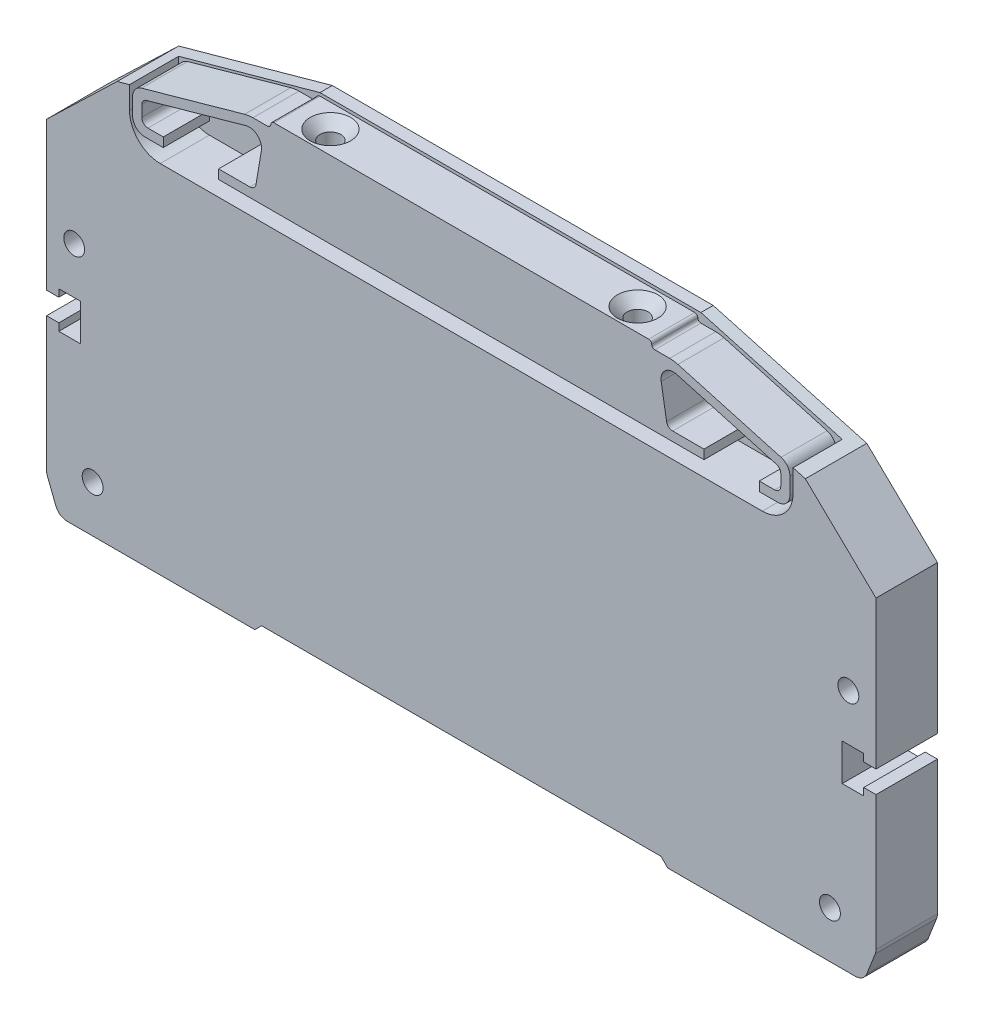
SolidWorks part; units mm, degrees
ref_plane "前视基准面" through (0, 0, 0) normal (0, 0, 1) x (1, 0, 0)
ref_plane "上视基准面" through (0, 0, 0) normal (0, 1, 0) x (1, 0, 0)
ref_plane "右视基准面" through (0, 0, 0) normal (1, 0, 0) x (0, 0, -1)
sketch "草图1" plane through (0, 0, 0) normal (0, 0, 1) x (1, 0, 0)
  line L0 (-67.5, 53.9) -> (-55.9997, 64.967)
  line L1 (-67.5, 29.8) -> (-67.5, 53.9)
  line L2 (-67.5, 29.8) -> (-65.5, 29.8)
  line L3 (-65.5, 29.8) -> (-65.5, 31)
  line L4 (-65.5, 31) -> (-62, 31)
  line L5 (-62, 31) -> (-62, 25)
  line L6 (-65.5, 25) -> (-65.5, 26.2)
  line L7 (-62, 25) -> (-65.5, 25)
  line L8 (-65.5, 26.2) -> (-67.5, 26.2)
  line L9 (-67.5, 26.2) -> (-67.5, 4.3788)
  line L10 (-67.3608, 3.6488) -> (-65.9948, 0.1687)
  line L11 (-64.1333, -1.1) -> (-33.6, -1.1)
  line L12 (-33.6, -1.1) -> (-32.5, 0)
  line L13 (-32.5, 0) -> (32.5, 0)
  line L14 (33.6, -1.1) -> (32.5, 0)
  line L15 (33.6, -1.1) -> (64.1333, -1.1)
  line L16 (65.9948, 0.1687) -> (67.3604, 3.6479)
  line L17 (67.5, 4.3798) -> (67.5, 26.2)
  line L18 (67.5, 29.8) -> (67.5, 53.9)
  line L19 (55.9997, 64.967) -> (67.5, 53.9)
  line L20 (31, 71.9) -> (55.9997, 64.967)
  line L21 (31, 71.9) -> (-31, 71.9)
  line L22 (-55.9997, 64.967) -> (-31, 71.9)
  line L23 (67.5, 26.2) -> (65.5, 26.2)
  line L24 (65.5, 25) -> (65.5, 26.2)
  line L25 (65.5, 25) -> (62, 25)
  line L26 (62, 25) -> (62, 31)
  line L27 (62, 31) -> (65.5, 31)
  line L28 (65.5, 29.8) -> (65.5, 31)
  line L29 (65.5, 29.8) -> (67.5, 29.8)
  arc A0 (-67.5, 4.3788) -> (-67.3608, 3.6488) centre (-65.5, 4.382) ccw
  arc A1 (-65.9948, 0.1687) -> (-64.1333, -1.1) centre (-64.1333, 0.9) ccw
  arc A2 (67.3604, 3.6479) -> (67.5, 4.3798) centre (65.5, 4.382) ccw
  arc A3 (64.1333, -1.1) -> (65.9948, 0.1687) centre (64.1333, 0.9) ccw
extrude "凸台-拉伸1" add sketch "草图1" along normal blind 10
hole_wizard "打孔尺寸(%根据)内六角圆柱头螺钉的类型1" positions "草图2" profile "草图3" counterbore size "M3" standard "GB"
sketch "草图2" plane through (0, 0, 0) normal (0, 0, -1) x (-1, 0, 0)
  line L0 (0, 0) -> (0, 43.9171) construction
  line L1 (-33.6, -1.1) -> (-64.1333, -1.1) construction
  point P0 (-63, 38.6)
  point P2 (-60, 6.5)
  point P9 (60, 6.5)
  point P10 (63, 38.6)
  dimension "D1" = 126
  dimension "D2" = 120
  dimension "D3" = 7.6
  dimension "D4" = 32.1
sketch "草图3" plane through (63, 38.6, 0) normal (1, 0, 0) x (0, 1, 0)
  line L0 (0, 0) -> (0, 10)
  line L1 (0, 10) -> (1.7, 10)
  line L3 (1.7, 10) -> (1.7, 3.4)
  line L4 (3, 3.4) -> (1.7, 3.4)
  line L5 (3, 3.4) -> (3, 0.3)
  line L6 (3, 0.3) -> (3.3, 0)
  line L7 (3.3, 0) -> (0, 0)
  line L8 (-3, 0.3) -> (-3.3, 0) construction
  line L11 (0, -6.35) -> (0, 107.95) construction
  dimension "通孔孔直径" = 3.4
  dimension "通孔孔深度" = 10
  dimension "柱形沉头孔直径" = 6
  dimension "柱形沉头孔深度" = 3.4
  dimension "近端锥形沉头孔直径" = 6.6
  dimension "近端锥形沉头孔角度" = 90
sketch "草图4" plane through (0, 0, 10) normal (0, 0, -1) x (-1, 0, 0)
  line L0 (-31, 71.9) -> (31, 71.9) construction
  line L1 (-49, 56.9) -> (49, 56.9)
  line L2 (-54, 61.9) -> (-54, 97.0837)
  line L3 (-54, 97.0837) -> (54, 97.0837)
  line L4 (54, 61.9) -> (54, 97.0837)
  line L5 (-54, 56.9) -> (54, 97.0837) construction
  line L6 (-54, 97.0837) -> (54, 56.9) construction
  arc A0 (49, 56.9) -> (54, 61.9) centre (49, 61.9) ccw
  arc A1 (-49, 56.9) -> (-54, 61.9) centre (-49, 61.9) cw
  point P0 (0, 76.9918)
  dimension "D3" = 5
  dimension "D1" = 108
  dimension "D2" = 15
extrude "切除-拉伸1" cut sketch "草图4" along normal blind 8
sketch "草图5" plane through (0, 0, 10) normal (0, 0, 1) x (1, 0, 0)
  line L3 (-39.5, 59.4) -> (39.5, 59.4)
  line L4 (39.5, 59.4) -> (39.5, 60.9)
  line L5 (39.5, 60.9) -> (34.4, 60.9)
  line L6 (33.4138, 61.7343) -> (32.5361, 66.9593)
  line L7 (35.0485, 69.2164) -> (51.27, 64.6675)
  line L8 (52, 63.7046) -> (52, 61.9)
  line L9 (51, 60.9) -> (48.5, 60.9)
  line L10 (48.5, 60.9) -> (48.5, 59.4)
  line L11 (48.5, 59.4) -> (51.5, 59.4)
  line L12 (53.5, 61.4) -> (53.5, 64.0837)
  line L13 (52.04, 66.0094) -> (35.2622, 70.7143)
  line L14 (33.9122, 70.9) -> (31.5, 70.9)
  line L15 (30.5, 71.9) -> (-30.5, 71.9)
  line L16 (-31.5, 70.9) -> (-33.9122, 70.9)
  line L17 (-35.2622, 70.7143) -> (-52.04, 66.0094)
  line L18 (-53.5, 64.0837) -> (-53.5, 61.4)
  line L19 (-51.5, 59.4) -> (-48.5, 59.4)
  line L20 (-48.5, 59.4) -> (-48.5, 60.9)
  line L21 (-48.5, 60.9) -> (-51, 60.9)
  line L22 (-52, 61.9) -> (-52, 63.7046)
  line L23 (-51.27, 64.6675) -> (-35.0485, 69.2164)
  line L24 (-32.5361, 66.9593) -> (-33.4138, 61.7343)
  line L25 (-34.4, 60.9) -> (-39.5, 60.9)
  line L26 (-39.5, 60.9) -> (-39.5, 59.4)
  arc A0 (33.4138, 61.7343) -> (34.4, 60.9) centre (34.4, 61.9) ccw
  arc A1 (35.0485, 69.2164) -> (32.5361, 66.9593) centre (34.5085, 67.2906) ccw
  arc A2 (52, 63.7046) -> (51.27, 64.6675) centre (51, 63.7046) ccw
  arc A3 (51, 60.9) -> (52, 61.9) centre (51, 61.9) ccw
  arc A4 (51.5, 59.4) -> (53.5, 61.4) centre (51.5, 61.4) ccw
  arc A5 (53.5, 64.0837) -> (52.04, 66.0094) centre (51.5, 64.0837) ccw
  arc A6 (35.2622, 70.7143) -> (33.9122, 70.9) centre (33.9122, 65.9) ccw
  arc A7 (31, 71.4) -> (31.5, 70.9) centre (31.5, 71.4) ccw
  arc A8 (31, 71.4) -> (30.5, 71.9) centre (30.5, 71.4) ccw
  arc A9 (-30.5, 71.9) -> (-31, 71.4) centre (-30.5, 71.4) ccw
  arc A10 (-31.5, 70.9) -> (-31, 71.4) centre (-31.5, 71.4) ccw
  arc A11 (-33.9122, 70.9) -> (-35.2622, 70.7143) centre (-33.9122, 65.9) ccw
  arc A12 (-52.04, 66.0094) -> (-53.5, 64.0837) centre (-51.5, 64.0837) ccw
  arc A13 (-53.5, 61.4) -> (-51.5, 59.4) centre (-51.5, 61.4) ccw
  arc A14 (-52, 61.9) -> (-51, 60.9) centre (-51, 61.9) ccw
  arc A15 (-51.27, 64.6675) -> (-52, 63.7046) centre (-51, 63.7046) ccw
  arc A16 (-32.5361, 66.9593) -> (-35.0485, 69.2164) centre (-34.5085, 67.2906) ccw
  arc A17 (-34.4, 60.9) -> (-33.4138, 61.7343) centre (-34.4, 61.9) ccw
extrude "凸台-拉伸2" add sketch "草图5" against normal offset from surface (7.5 mm away) 0.5 separate body
hole_wizard "打孔尺寸(%根据十字)槽半沉头木螺钉的类型1" positions "草图6" profile "草图7" countersink size "M3" standard "GB"
sketch "草图6" plane through (0, 71.9, 0) normal (0, 1, 0) x (1, 0, 0)
  line L0 (0, 0) -> (0, -13.4782) construction
  line L1 (-30.5, -2.5) -> (30.5, -2.5) construction
  point P0 (-25, -6.3)
  point P7 (25, -6.3)
  dimension "D1" = 50
  dimension "D2" = 3.8
sketch "草图7" plane through (-25, 71.9, 6.3) normal (1, 0, 0) x (0, 0, 1)
  line L0 (0, 0) -> (0, 71.9)
  line L1 (0, 71.9) -> (1.7, 71.9)
  line L2 (1.7, 71.9) -> (1.7, 1.6)
  line L3 (1.7, 1.6) -> (3.3, 0)
  line L5 (3.3, 0) -> (0, 0)
  line L6 (-1.7, 1.6) -> (-3.3, 0) construction
  line L11 (0, -6.35) -> (0, 107.95) construction
  dimension "通孔孔直径" = 3.4
  dimension "通孔孔深度" = 71.9
  dimension "近端锥形沉头孔直径" = 6.6
  dimension "近端锥形沉头孔角度" = 90
